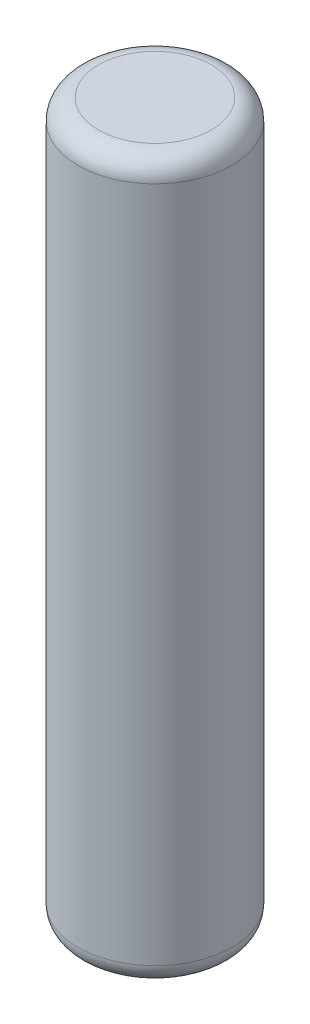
SolidWorks part; units mm, degrees
ref_plane "Спереди" through (0, 0, 0) normal (0, 0, 1) x (1, 0, 0)
ref_plane "Сверху" through (0, 0, 0) normal (0, 1, 0) x (1, 0, 0)
ref_plane "Справа" through (0, 0, 0) normal (1, 0, 0) x (0, 0, -1)
sketch "Эскиз1" plane through (0, 0, 0) normal (0, 1, 0) x (1, 0, 0)
  circle A0 centre (0, 0) radius 0.375
  dimension "D1" = 0.75
extrude "Бобышка-Вытянуть1" add sketch "Эскиз1" along normal blind 3.5
fillet "Скругление1" radius 0.1 2 edges at (0, 0, 0.375) (0, 3.5, 0.375)
